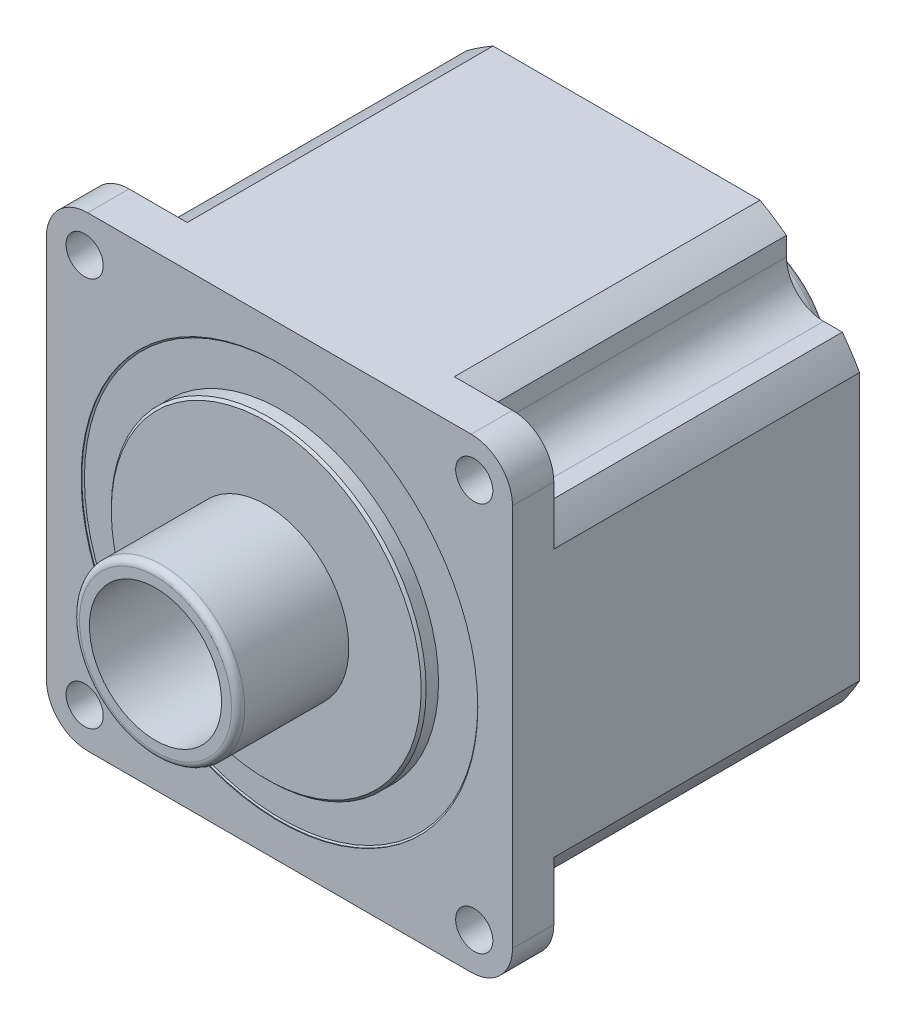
SolidWorks part; units mm, degrees
ref_plane "正面" through (0, 0, 0) normal (0, 0, 1) x (1, 0, 0)
ref_plane "平面" through (0, 0, 0) normal (0, 1, 0) x (1, 0, 0)
ref_plane "右側面" through (0, 0, 0) normal (1, 0, 0) x (0, 0, -1)
sketch "ｽｹｯﾁ1" plane through (0, 0, 0) normal (0, 0, 1) x (1, 0, 0)
  circle A0 centre (0, 0) radius 10
  dimension "D1" = 20
extrude "押し出し1" add sketch "ｽｹｯﾁ1" along normal blind 13.4
sketch "ｽｹｯﾁ2" plane through (0, 0, 0) normal (0, 0, -1) x (-1, 0, 0)
  circle A0 centre (0, 0) radius 19.05
  dimension "D1" = 38.1
extrude "押し出し2" add sketch "ｽｹｯﾁ2" along normal blind 1.6
sketch "ｽｹｯﾁ3" plane through (0, 0, -1.6) normal (0, 0, -1) x (-1, 0, 0)
  line L1 (-28.2, 28.2) -> (28.2, 28.2)
  line L2 (-28.2, 28.2) -> (-28.2, -28.2)
  line L3 (-28.2, -28.2) -> (28.2, -28.2)
  line L4 (28.2, 28.2) -> (28.2, -28.2)
  line L5 (-28.2, 28.2) -> (28.2, -28.2) construction
  line L6 (-28.2, -28.2) -> (28.2, 28.2) construction
  line L7 (23.57, 23.57) -> (-23.57, 23.57) construction
  line L8 (23.57, 23.57) -> (23.57, -23.57) construction
  line L9 (23.57, -23.57) -> (-23.57, -23.57) construction
  line L10 (-23.57, 23.57) -> (-23.57, -23.57) construction
  line L11 (23.57, 23.57) -> (-23.57, -23.57) construction
  line L12 (23.57, -23.57) -> (-23.57, 23.57) construction
  circle A0 centre (23.57, 23.57) radius 2.25
  circle A1 centre (-23.57, 23.57) radius 2.25
  circle A2 centre (23.57, -23.57) radius 2.25
  circle A3 centre (-23.57, -23.57) radius 2.25
  point P0 (0, 0)
  point P6 (0, 0)
  dimension "D3" = 47.14
  dimension "D4" = 47.14
  dimension "D6" = 4.5
  dimension "D1" = 56.4
  dimension "D2" = 56.4
extrude "押し出し3" add sketch "ｽｹｯﾁ3" along normal blind 5
fillet "Fillet1" radius 5 4 edges at (28.2, -28.2, -4.1) (-28.2, -28.2, -4.1) (-28.2, 28.2, -4.1) (28.2, 28.2, -4.1)
sketch "ｽｹｯﾁ4" plane through (0, 0, -6.6) normal (0, 0, -1) x (-1, 0, 0)
  line L0 (19.35, 19.35) -> (28.2, 19.35)
  line L1 (-19.35, 28.2) -> (19.35, 28.2)
  line L2 (-19.35, 28.2) -> (-19.35, 19.35)
  line L3 (-19.35, -28.2) -> (19.35, -28.2)
  line L4 (19.35, 28.2) -> (19.35, 19.35)
  line L5 (-19.35, 28.2) -> (19.35, -28.2) construction
  line L6 (-19.35, -28.2) -> (19.35, 28.2) construction
  line L7 (-28.2, 19.35) -> (-19.35, 19.35)
  line L8 (-28.2, 19.35) -> (-28.2, -19.35)
  line L9 (-28.2, -19.35) -> (-19.35, -19.35)
  line L10 (28.2, 19.35) -> (28.2, -19.35)
  line L11 (-28.2, 19.35) -> (28.2, -19.35) construction
  line L12 (-28.2, -19.35) -> (28.2, 19.35) construction
  line L13 (-19.35, -19.35) -> (-19.35, -28.2)
  line L14 (19.35, -19.35) -> (28.2, -19.35)
  line L15 (19.35, -19.35) -> (19.35, -28.2)
  circle A0 centre (0, 0) radius 32.5
  point P0 (0, 0)
  point P6 (0, 0)
  dimension "D5" = 65
  dimension "D1" = 38.7
  dimension "D2" = 56.4
  dimension "D3" = 56.4
  dimension "D4" = 38.7
extrude "押し出し4" add sketch "ｽｹｯﾁ4" along normal blind 37 contours L10 A0 L0 L4 L1 L2 L7 L8 L9 L13 L3 L15 L14
fillet "Fillet2" radius 4.5 4 edges at (19.35, -19.35, -25.1) (-19.35, -19.35, -25.1) (-19.35, 19.35, -25.1) (19.35, 19.35, -25.1)
fillet "Fillet3" radius 0.8 1 edges at (10, 0, 13.4)
sketch "Sketch6" plane through (0, 0, -1.6) normal (0, 0, 1) x (1, 0, 0)
  circle A0 centre (0, 0) radius 19.05 construction
  circle A1 centre (0, 0) radius 24
  circle A2 centre (0, 0) radius 19.05
  dimension "D1" = 48
extrude "Extrude6" cut sketch "Sketch6" against normal blind 0.2
chamfer "Chamfer2" distance 0.3 angle 45 1 edges at (-19.05, 0, 0)
chamfer "Chamfer5" distance 0.2 angle 30 1 edges at (24, 0, -1.8)
sketch "Sketch4" plane through (0, 0, -43.6) normal (0, 0, -1) x (-1, 0, 0)
  circle A0 centre (0, 0) radius 10
  dimension "D1" = 20
extrude "Extrude4" add sketch "Sketch4" along normal blind 15
fillet "Fillet4" radius 0.8 1 edges at (-10, 0, -58.6)
sketch "Sketch8" plane through (0, 0, 13.4) normal (0, 0, 1) x (1, 0, 0)
  circle A0 centre (0, 0) radius 8
  dimension "D1" = 16
extrude "Extrude8" cut sketch "Sketch8" against normal through all
